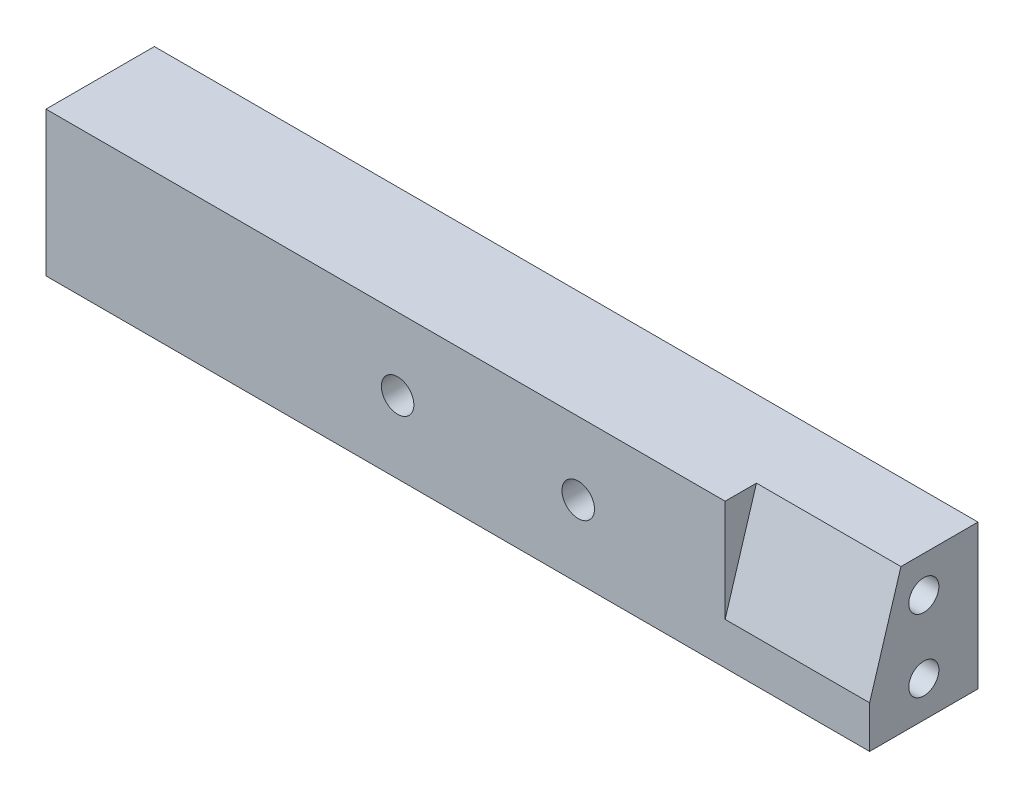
SolidWorks part; units mm, degrees
ref_plane "Plano frontal" through (0, 0, 0) normal (0, 0, 1) x (1, 0, 0)
ref_plane "Plano superior" through (0, 0, 0) normal (0, 1, 0) x (1, 0, 0)
ref_plane "Plano direito" through (0, 0, 0) normal (1, 0, 0) x (0, 0, -1)
sketch "Esboço1" plane through (0, 0, 0) normal (1, 0, 0) x (0, 0, -1)
  line L0 (3.0266, 6) -> (4.5, 6)
  line L1 (-4.5, -6) -> (4.5, -6)
  line L2 (-4.5, -6) -> (-4.5, 6)
  line L3 (-4.5, 6) -> (4.5, 6) construction
  line L4 (4.5, -6) -> (4.5, 6) construction
  line L5 (-4.5, -6) -> (4.5, 6) construction
  line L6 (-4.5, 6) -> (4.5, -6) construction
  line L7 (4.5, 6) -> (4.5, -6)
  line L8 (-4.5, 6) -> (3.0266, 6)
  point P0 (0, 0)
  dimension "D1" = 12
  dimension "D2" = 9
  dimension "D4" = 12.0901
extrude "Ressalto-extrusão1" add sketch "Esboço1" along normal mid plane 68.4
sketch "Esboço2" plane through (34.2, 0, 0) normal (1, 0, 0) x (0, 0, -1)
  line L0 (-4.5, -2.5) -> (-1.9, 6) construction
  line L1 (-4.5, 6) -> (-4.5, -6) construction
  line L2 (-1.9, 6) -> (-4.5, -2.5)
  line L3 (-4.5, -2.5) -> (-4.5, 6)
  line L4 (-4.5, 6) -> (-4.5, -6)
  line L5 (-4.5, -6) -> (4.5, -6)
  line L6 (4.5, -6) -> (4.5, 6)
  line L7 (4.5, 6) -> (-4.5, 6)
  line L8 (-4.5, 6) -> (-4.5, -6) construction
  line L9 (-4.5, -6) -> (4.5, -6) construction
  line L10 (4.5, -6) -> (4.5, 6)
  line L11 (4.5, 6) -> (-4.5, 6) construction
  line L12 (-4.5, 6) -> (-1.9, 6)
  dimension "D2" = 8.5
  dimension "D3" = 6.4
  dimension "D1" = 0
sketch "Esboço3" plane through (34.2, 0, 0) normal (1, 0, 0) x (0, 0, -1)
  line L1 (4.5, 6) -> (-4.5, 6) construction
  line L2 (-4.5, -6) -> (4.5, -6) construction
  line L3 (0, -6) -> (0, 6) construction
  point P6 (0, 3)
  point P10 (0, -3)
  dimension "D1" = 3
  dimension "D2" = 3
hole_wizard "Furo roscado de M3x0.51" positions "Esboço5" profile "Esboço4" tap size "M3x0.5" standard "Ansi Metric"
sketch "Esboço5" plane through (34.2, 0, 0) normal (1, 0, 0) x (0, 0, -1)
  point P0 (0, -3)
  point P7 (0, 3)
sketch "Esboço4" plane through (34.2, -3, 0) normal (0, 1, 0) x (0, 0, -1)
  line L0 (0, 0) -> (0, 9.2511)
  line L1 (0, 9.2511) -> (1.25, 8.5)
  line L2 (1.25, 8.5) -> (1.25, 0)
  line L5 (1.25, 0) -> (0, 0)
  line L10 (0, 9.2511) -> (-1.25, 8.5) construction
  line L11 (0, -6.35) -> (0, 107.95) construction
  dimension "Tap Drill Dia." = 2.5
  dimension "Tap Drill Depth" = 8.5
  dimension "Drill Angle" = 118
sketch "Esboço6" plane through (-34.2, 0, 0) normal (-1, 0, 0) x (0, 0, 1)
  line L0 (0, -6) -> (0, 6) construction
  line L1 (4.5, -6) -> (-4.5, -6) construction
  line L2 (-4.5, 6) -> (4.5, 6) construction
  point P7 (0, -3)
  point P8 (0, 3)
  dimension "D1" = 3
  dimension "D2" = 3
hole_wizard "Furo roscado de M3x0.52" positions "Esboço8" profile "Esboço7" tap size "M3x0.5" standard "Ansi Metric"
sketch "Esboço8" plane through (-34.2, 0, 0) normal (-1, 0, 0) x (0, 0, 1)
  point P0 (0, 3)
  point P3 (0, -3)
sketch "Esboço7" plane through (-34.2, 3, 0) normal (0, 1, 0) x (0, 0, 1)
  line L0 (0, 0) -> (0, 9.2511)
  line L1 (0, 9.2511) -> (1.25, 8.5)
  line L2 (1.25, 8.5) -> (1.25, 0)
  line L5 (1.25, 0) -> (0, 0)
  line L10 (0, 9.2511) -> (-1.25, 8.5) construction
  line L11 (0, -6.35) -> (0, 107.95) construction
  dimension "Tap Drill Dia." = 2.5
  dimension "Tap Drill Depth" = 8.5
  dimension "Drill Angle" = 118
sketch "Esboço9" plane through (0, -12.5037, -4.5) normal (0, 0, 1) x (-1, 0, 0)
  line L3 (-34.2, -6.5037) -> (34.2, -6.5037) construction
  line L4 (-34.2, -6.5037) -> (34.2, -6.5037) construction
  line L5 (34.2, -6.5037) -> (34.2, -18.5037) construction
  line L6 (34.2, -18.5037) -> (-34.2, -18.5037) construction
  line L7 (-34.2, -18.5037) -> (-34.2, -6.5037) construction
  line L8 (-34.2, -6.5037) -> (34.2, -6.5037) construction
  circle A0 centre (-29.2, -12.5037) radius 1.5 construction
  circle A5 centre (-44.2, -12.5037) radius 1.5 construction
  dimension "D3" = 3
  dimension "D4" = 3
  dimension "D5" = 44.2
  dimension "D6" = 15
  dimension "D7" = 6
sketch "Sketch1" plane through (0, 0, -4.5) normal (0, 0, -1) x (-1, 0, 0)
  circle A0 centre (-10, 0) radius 1.35
  circle A1 centre (5, 0) radius 1.35
  dimension "D1" = 15
  dimension "D3" = 2.7
  dimension "D2" = 10
extrude "Cut-Extrude1" cut sketch "Sketch1" against normal through all
extrude "Corte-extrusão1" cut sketch "Esboço2" against normal blind 12 contours L2 M11 M8 M9
